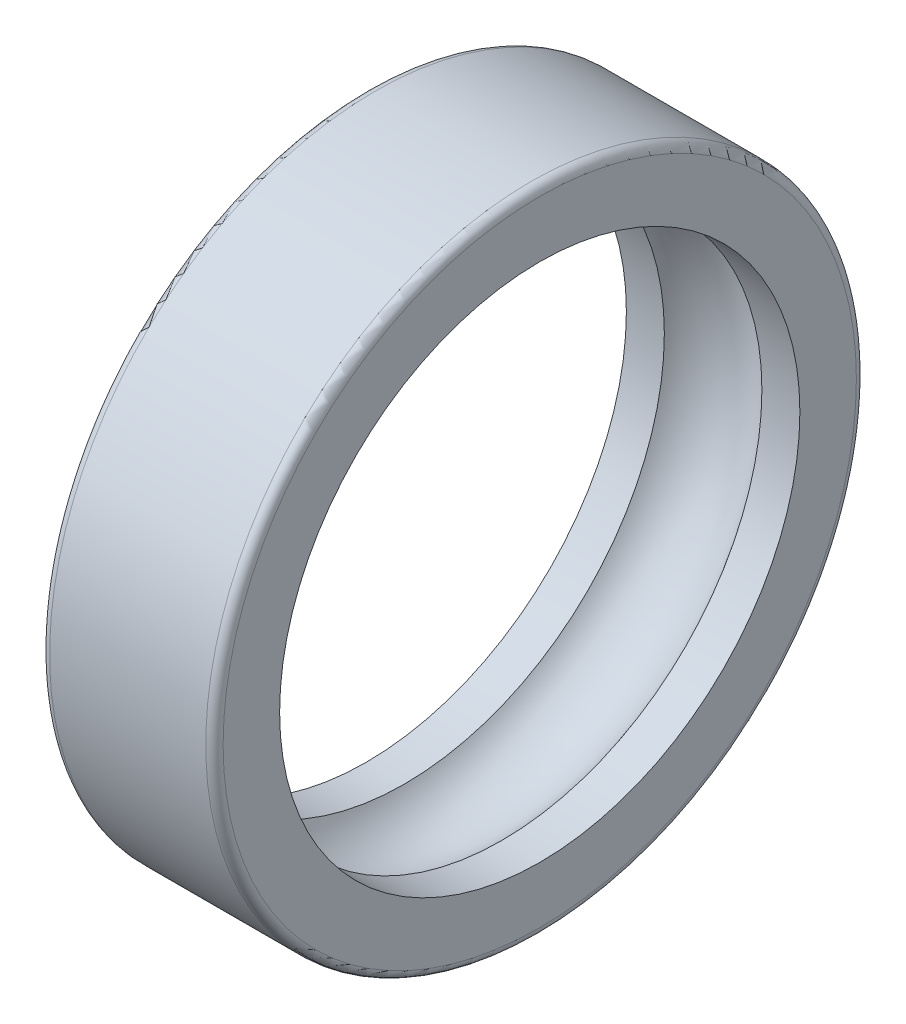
SolidWorks part; units mm, degrees
ref_plane "Plan de face" through (0, 0, 0) normal (0, 0, 1) x (1, 0, 0)
ref_plane "Plan de dessus" through (0, 0, 0) normal (0, 1, 0) x (1, 0, 0)
ref_plane "Plan de droite" through (0, 0, 0) normal (1, 0, 0) x (0, 0, -1)
sketch "Esquisse1" plane through (0, 0, 0) normal (0, 0, 1) x (1, 0, 0)
  line L0 (0, 14.6) -> (0, 11.994)
  line L1 (0, 11.994) -> (1.751, 11.994)
  line L2 (6.249, 11.994) -> (8, 11.994)
  line L3 (8, 11.994) -> (8, 14.6)
  line L4 (7.6, 15) -> (0.4, 15)
  line L5 (8, 0) -> (0, 0) construction
  arc A0 (1.751, 11.994) -> (6.249, 11.994) centre (4, 10.5) cw
  arc A1 (8, 14.6) -> (7.6, 15) centre (7.6, 14.6) ccw
  arc A2 (0.4, 15) -> (0, 14.6) centre (0.4, 14.6) ccw
revolve "Révolution1" add sketch "Esquisse1" angle 360 about L5
